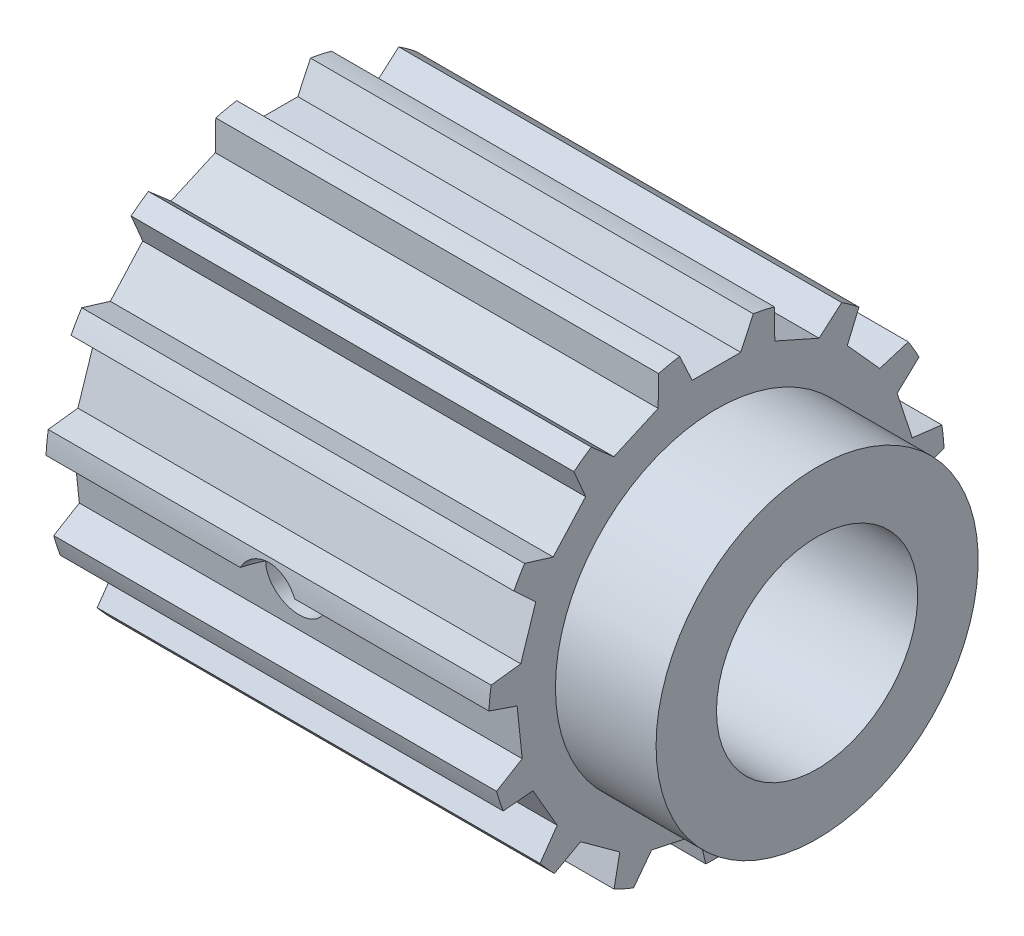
SolidWorks part; units mm, degrees
ref_plane "Plan de face" through (0, 0, 0) normal (0, 0, 1) x (1, 0, 0)
ref_plane "Plan de dessus" through (0, 0, 0) normal (0, 1, 0) x (1, 0, 0)
ref_plane "Plan de droite" through (0, 0, 0) normal (1, 0, 0) x (0, 0, -1)
sketch "Esquisse1" plane through (0, 0, 0) normal (0, 0, 1) x (1, 0, 0)
  line L0 (-12.2548, 0) -> (24.5095, 0) construction
  line L1 (0, 5) -> (0, 8)
  line L2 (0, 8) -> (-5, 8)
  line L3 (-5, 8) -> (-5, 11.325)
  line L4 (-5, 11.325) -> (-27, 11.325)
  line L5 (-27, 11.325) -> (-27, 5)
  line L6 (-27, 5) -> (0, 5)
  dimension "D1" = 10
  dimension "D2" = 16
  dimension "D3" = 22.65
  dimension "D4" = 5
  dimension "D5" = 22
revolve "Révolution1" add sketch "Esquisse1" angle 360 about L0
sketch "Esquisse2" plane through (0, 0, 0) normal (0, 0, 1) x (1, 0, 0)
  circle A0 centre (-16, 0) radius 1.5
  dimension "D1" = 3
  dimension "D2" = 16
extrude "Enlèv. mat.-Extru.1" cut sketch "Esquisse2" against normal through all and the other way through all
sketch "Esquisse3" plane through (-27, 0, 0) normal (-1, 0, 0) x (0, 0, 1)
  line L0 (-2.16, 11.8802) -> (-1.2041, 9.8302)
  line L1 (-1.2041, 9.8302) -> (1.2041, 9.8302)
  line L2 (1.2041, 9.8302) -> (2.16, 11.8802)
  line L3 (0, 0) -> (0, 13.7521) construction
  arc A0 (-2.16, 11.8802) -> (2.16, 11.8802) centre (0, 0) cw
  dimension "D3" = 12.075
  dimension "D1" = 25
  dimension "D2" = 25
  dimension "D4" = 2.05
  dimension "D5" = 4.32
extrude "Enlèv. mat.-Extru.2" cut sketch "Esquisse3" against normal up to next
pattern_circular "Répétition circulaire1" count 15 every 24 about axis through (0, 0, 0) along (1, 0, 0) of "Enlèv. mat.-Extru.2"
